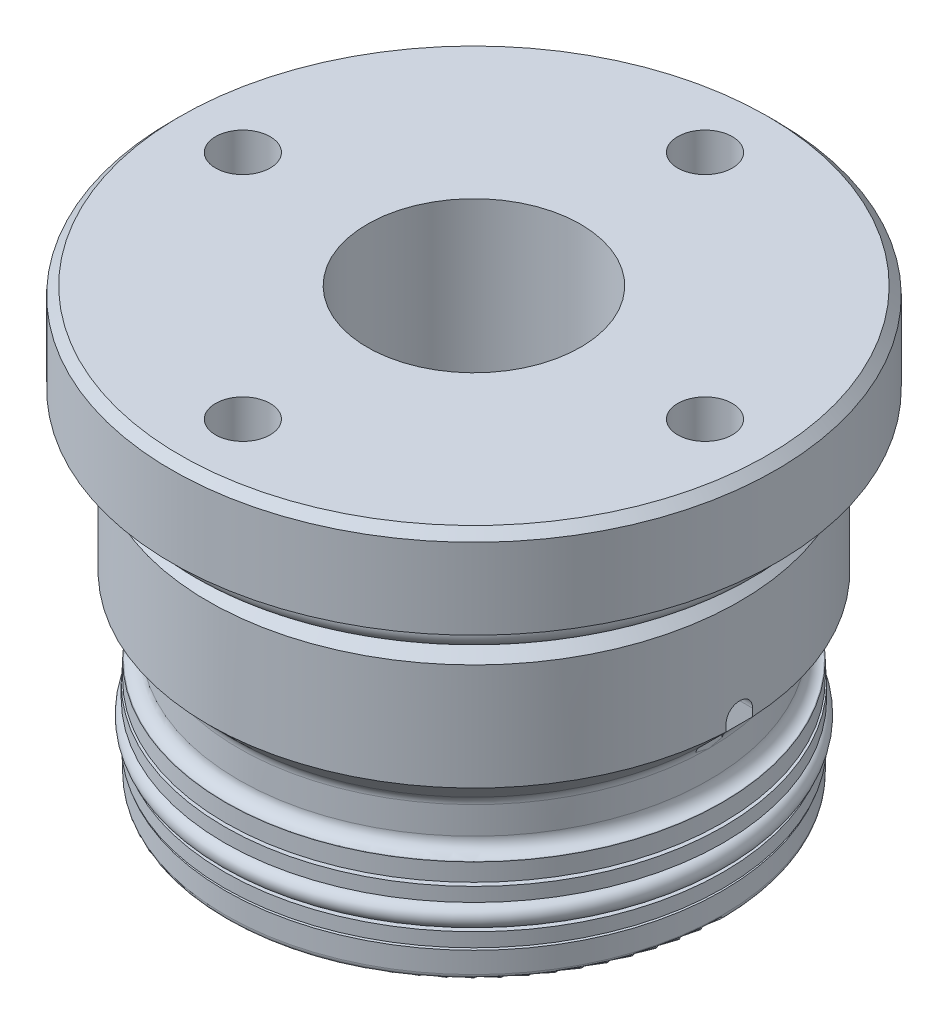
SolidWorks part; units mm, degrees
ref_plane "Front Plane" through (0, 0, 0) normal (0, 0, 1) x (1, 0, 0)
ref_plane "Top Plane" through (0, 0, 0) normal (0, 1, 0) x (1, 0, 0)
ref_plane "Right Plane" through (0, 0, 0) normal (1, 0, 0) x (0, 0, -1)
sketch "Sketch1" plane through (0, 0, 0) normal (0, 0, 1) x (1, 0, 0)
  line L0 (0, 0) -> (0, 29.1031) construction
  line L1 (-17.4625, 0) -> (-17.4625, 18.2372)
  line L2 (-17.4625, 18.2372) -> (-9.525, 18.2372)
  line L3 (-9.525, 18.2372) -> (-9.525, 38.1)
  line L4 (-9.525, 38.1) -> (-26.9875, 38.1)
  line L5 (-26.9875, 38.1) -> (-26.9875, 30.1498)
  line L6 (-26.9875, 30.1498) -> (-23.7363, 30.1498)
  line L7 (-23.7363, 30.1498) -> (-23.7363, 16.0274)
  line L8 (-23.7363, 16.0274) -> (-20.9931, 13.2842)
  line L9 (-20.9931, 13.2842) -> (-20.9931, 9.2202)
  line L10 (-20.9931, 9.2202) -> (-22.1869, 9.2202)
  line L11 (-22.1869, 9.2202) -> (-22.1869, 7.6454)
  line L12 (-22.1869, 7.6454) -> (-20.9296, 7.6454)
  line L13 (-20.9296, 7.6454) -> (-20.9296, 2.3876)
  line L14 (-20.9296, 2.3876) -> (-22.1869, 2.3876)
  line L15 (-22.1869, 2.3876) -> (-22.1869, 0)
  line L16 (-22.1869, 0) -> (-17.4625, 0)
  dimension "D1" = 18.2372
  dimension "D2" = 38.1
  dimension "D3" = 53.975
  dimension "D4" = 19.05
  dimension "D5" = 34.925
  dimension "D6" = 44.3738
  dimension "D7" = 2.3876
  dimension "D8" = 1.5748
  dimension "D9" = 41.8592
  dimension "D10" = 5.2578
  dimension "D11" = 30.1498
  dimension "D12" = 47.4726
  dimension "D13" = 41.9862
  dimension "D14" = 16.0274
  dimension "D15" = 45
revolve "Revolve1" add sketch "Sketch1" angle 360 about L0
fillet "Fillet1" radius 1.143 2 edges at (0, 13.2842, -20.9931) (0, 9.2202, -20.9931)
fillet "Fillet2" radius 0.381 2 edges at (0, 7.6454, -20.9296) (0, 2.3876, -20.9296)
fillet "Fillet3" radius 0.508 1 edges at (0, 0, -22.1869)
hole_wizard "Hole1" positions "Sketch3" profile "Sketch2" legacy
sketch "Sketch3" plane through (0, 38.1, 0) normal (0, 1, 0) x (-1, 0, 0)
  circle A0 centre (0, 0) radius 20.6375 construction
  point P0 (-20.6375, 0)
  dimension "D1" = 20.6375
sketch "Sketch2" plane through (20.6375, 38.1, 0) normal (1, 0, 0) x (0, 0, 1)
  line L0 (0, 0) -> (0, 6.2149)
  line L1 (0, 6.2149) -> (2.4384, 4.7498)
  line L2 (2.4384, 4.7498) -> (2.4384, 0)
  line L4 (2.4384, 0) -> (0, 0)
  line L6 (0, 6.2149) -> (-2.4384, 4.7498) construction
  line L7 (0, -4.2442) -> (0, 117.3081) construction
  dimension "Diameter" = 4.8768
  dimension "Depth" = 4.7498
  dimension "Drill Angle" = 118
pattern_circular "CirPattern1" count 4 over 360 about axis through (0, 0, 0) along (0, 1, 0) of "Hole1"
chamfer "Chamfer1" distance 0.762 angle 45 1 edges at (0, 38.1, -26.9875)
sketch "Sketch4" plane through (0, 0, 0) normal (0, 0, 1) x (1, 0, 0)
  line L0 (0, 0) -> (0, 41.4124) construction
  line L1 (-23.7363, 30.1498) -> (-23.7363, 25.5524)
  line L2 (-23.7363, 30.1498) -> (-23.7363, 16.0274) construction
  line L3 (-23.7363, 25.5524) -> (-22.5933, 26.6954)
  line L4 (-22.5933, 26.6954) -> (-22.5933, 30.1498)
  line L5 (-23.7363, 30.1498) -> (23.7363, 30.1498) construction
  line L6 (-22.5933, 30.1498) -> (-23.7363, 30.1498)
  line L8 (-21.6789, 0) -> (21.6789, 0) construction
  dimension "D1" = 45.1866
  dimension "D3" = 45
  dimension "D4" = 26.6954
revolve "Cut-Revolve1" cut sketch "Sketch4" angle 360 about L0
fillet "Fillet4" radius 0.381 2 edges at (0, 26.6954, -22.5933) (0, 30.1498, -22.5933)
sketch "Sketch5" plane through (0, 0, 0) normal (0, 0, 1) x (1, 0, 0)
  line L0 (-26.9875, 30.1498) -> (26.9875, 30.1498) construction
  line L1 (0, 0) -> (0, 42.572) construction
  circle A0 centre (-23.8633, 28.8036) radius 1.3081
  dimension "D2" = 2.6162
  dimension "D1" = 1.3462
  dimension "D3" = 47.7266
revolve "Revolve2" add sketch "Sketch5" angle 360 about L1
sketch "Sketch6" plane through (0, 0, 0) normal (0, 0, 1) x (1, 0, 0)
  line L0 (0, 0) -> (0, 49.5791) construction
  line L1 (-20.9296, 7.2644) -> (-20.9296, 2.7686) construction
  line L2 (-20.9296, 6.1468) -> (-22.2758, 6.1468)
  line L3 (-20.9296, 6.1468) -> (-20.9296, 7.3914)
  line L4 (-20.9296, 7.3914) -> (-22.2758, 7.3914)
  line L5 (-22.2758, 6.1468) -> (-22.2758, 7.3914)
  line L6 (-20.9296, 5.0165) -> (-17.8863, 5.0165) construction
  line L7 (-22.2758, 3.8862) -> (-22.2758, 2.6416)
  line L8 (-20.9296, 2.6416) -> (-22.2758, 2.6416)
  line L9 (-20.9296, 3.8862) -> (-20.9296, 2.6416)
  line L10 (-20.9296, 3.8862) -> (-22.2758, 3.8862)
  line L11 (22.1869, 2.3876) -> (-22.1869, 2.3876) construction
  circle A0 centre (-21.7678, 4.9276) radius 0.889
  dimension "D4" = 1.778
  dimension "D5" = 43.5356
  dimension "D6" = 2.54
  dimension "D1" = 1.2446
  dimension "D2" = 44.5516
  dimension "D3" = 2.2606
revolve "Revolve3" add sketch "Sketch6" angle 360 about L0
sketch "Sketch7" plane through (0, 0, 0) normal (1, 0, 0) x (0, 0, -1)
  line L0 (-21.6789, 0) -> (21.6789, 0) construction
  circle A0 centre (0, 16.6878) radius 1.1811
  dimension "D1" = 2.3622
  dimension "D2" = 16.6878
extrude "Cut-Extrude1" cut sketch "Sketch7" against normal through all and the other way through all
sketch "Sketch8" plane through (0, 0, 0) normal (1, 0, 0) x (0, 0, -1)
  line L0 (-1.1811, 16.6878) -> (-1.1811, 11.9253)
  line L1 (0, 16.6878) -> (0, 11.9253) construction
  line L2 (1.1811, 16.6878) -> (1.1811, 11.9253)
  arc A0 (1.1811, 16.6878) -> (-1.1811, 16.6878) centre (0, 16.6878) ccw
  arc A1 (-1.1811, 11.9253) -> (1.1811, 11.9253) centre (0, 11.9253) ccw
  arc A2 (-0.9792, 16.0274) -> (0.9792, 16.0274) centre (0, 16.6878) ccw construction
  dimension "D1" = 4.7625
extrude "Cut-Extrude3" cut sketch "Sketch8" along normal blind 27.686 from offset 20.9931
mirror "Mirror1" about plane through (0, 0, 0) normal (1, 0, 0) of "Cut-Extrude3"
